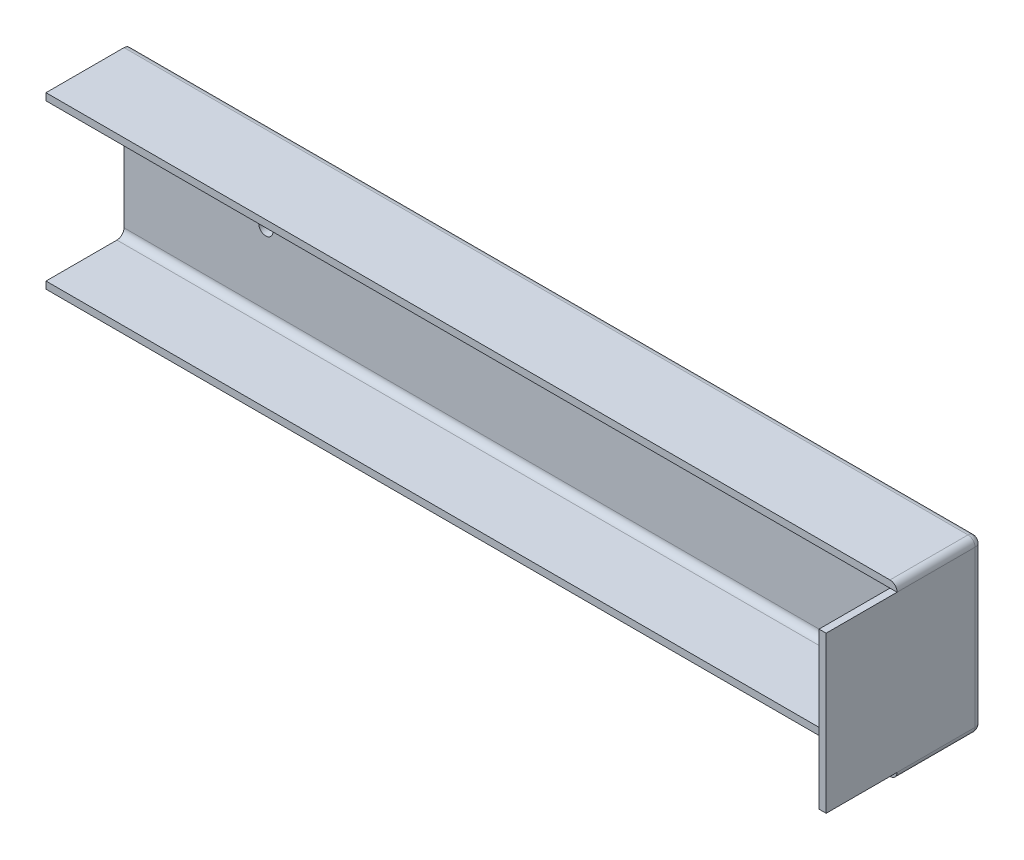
SolidWorks part; units mm, degrees
ref_plane "Plan de face" through (0, 0, 0) normal (0, 0, 1) x (1, 0, 0)
ref_plane "Plan de dessus" through (0, 0, 0) normal (0, 1, 0) x (1, 0, 0)
ref_plane "Plan de droite" through (0, 0, 0) normal (1, 0, 0) x (0, 0, -1)
sketch "Esquisse1" plane through (0, 0, 0) normal (0, 0, 1) x (1, 0, 0)
  line L1 (-120, 24) -> (120, 24)
  line L2 (-120, 24) -> (-120, -24)
  line L3 (-120, -24) -> (120, -24)
  line L4 (120, 24) -> (120, -24)
  line L5 (-120, 24) -> (120, -24) construction
  line L6 (-120, -24) -> (120, 24) construction
  point P0 (0, 0)
  dimension "D1" = 240
  dimension "D2" = 48
extrude "Boss.-Extru.1" add sketch "Esquisse1" along normal blind 24
sketch "Esquisse2" plane through (0, 0, 24) normal (0, 0, 1) x (1, 0, 0)
  line L0 (120, -24) -> (120, 24) construction
  line L1 (-120, 22) -> (120, 22)
  line L2 (-120, 22) -> (-120, -22)
  line L3 (-120, -22) -> (120, -22)
  line L4 (120, 22) -> (120, -22)
  line L5 (-120, 22) -> (120, -22) construction
  line L6 (-120, -22) -> (120, 22) construction
  point P0 (0, 0)
  dimension "D1" = 44
extrude "Enlèv. mat.-Extru.1" cut sketch "Esquisse2" against normal blind 22
fillet "Congé1" radius 2 1 edges at (0, 24, 0)
fillet "Congé2" radius 2 3 edges at (0, -24, 0) (0, 22, 2) (0, -22, 2)
sketch "Esquisse4" plane through (120, 0, 0) normal (1, 0, 0) x (0, 0, -1)
  line L5 (-4, 22) -> (-24, 22) construction
  line L6 (-44, 22) -> (0, 22)
  line L7 (-44, 22) -> (-44, -22)
  line L8 (-44, -22) -> (0, -22)
  line L9 (0, 22) -> (0, -22)
  line L10 (0, -22) -> (0, 22) construction
  dimension "D1" = 44
  dimension "D2" = 44
extrude "Boss.-Extru.2" add sketch "Esquisse4" against normal blind 2
fillet "Congé3" radius 2 5 edges at (120, -24, 13) (120, -23.4142, 0.5858) (120, 24, 13) (120, 23.4142, 0.5858) (120, 0, 0)
sketch "Esquisse5" plane through (0, 0, 2) normal (0, 0, 1) x (1, 0, 0)
  line L0 (-120, 20) -> (-120, -20) construction
  circle A0 centre (-80, 0) radius 2
  point P0 (-80, 0)
  point P3 (-120, 0)
  dimension "D1" = 40
extrude "Enlèv. mat.-Extru.2" cut sketch "Esquisse5" against normal blind 2
